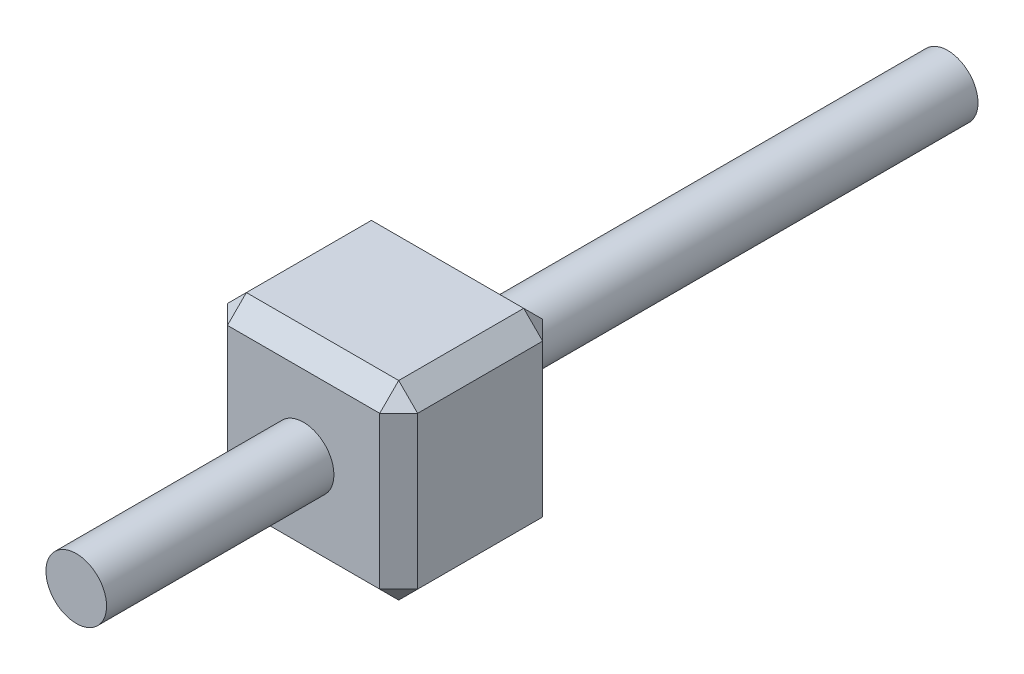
SolidWorks part; units mm, degrees
ref_plane "Face" through (0, 0, 0) normal (0, 0, 1) x (1, 0, 0)
ref_plane "Dessus" through (0, 0, 0) normal (0, 1, 0) x (1, 0, 0)
ref_plane "Droite" through (0, 0, 0) normal (1, 0, 0) x (0, 0, -1)
sketch "Esquisse1" plane through (0, 0, 0) normal (0, 0, 1) x (1, 0, 0)
  line L0 (-29.2454, 24.3197) -> (-29.2454, 21.8097) construction
  line L1 (-30.5004, 24.3197) -> (-27.9904, 24.3197)
  line L2 (-30.5004, 24.3197) -> (-30.5004, 21.8097)
  line L3 (-30.5004, 21.8097) -> (-27.9904, 21.8097)
  line L4 (-27.9904, 24.3197) -> (-27.9904, 21.8097)
  dimension "D1" = 2.51
  dimension "D2" = 2.51
extrude "Extrusion1" add sketch "Esquisse1" along normal blind 2.15
sketch "Esquisse2" plane through (0, 0, 2.15) normal (0, 0, 1) x (1, 0, 0)
  line L0 (-29.2454, 24.3197) -> (-29.2454, 21.8097) construction
  line L1 (-27.9904, 24.3197) -> (-30.5004, 24.3197) construction
  line L2 (-30.5004, 21.8097) -> (-27.9904, 21.8097) construction
  circle A0 centre (-29.2454, 23.0647) radius 0.4
  dimension "D1" = 0.8
extrude "Extrusion2" add sketch "Esquisse2" along normal blind 3 and the other way blind 8.5
chamfer "Chanfrein1" distance 0.25 angle 45 12 edges at (-27.9904, 23.0647, 2.15) (-29.2454, 24.3197, 2.15) (-30.5004, 23.0647, 2.15) (-29.2454, 24.3197, 0) (-27.9904, 23.0647, 0) (-29.2454, 21.8097, 0) (-30.5004, 23.0647, 0) (-29.2454, 21.8097, 2.15) (-30.5004, 24.3197, 1.075) (-27.9904, 24.3197, 1.075) (-27.9904, 21.8097, 1.075) (-30.5004, 21.8097, 1.075)
